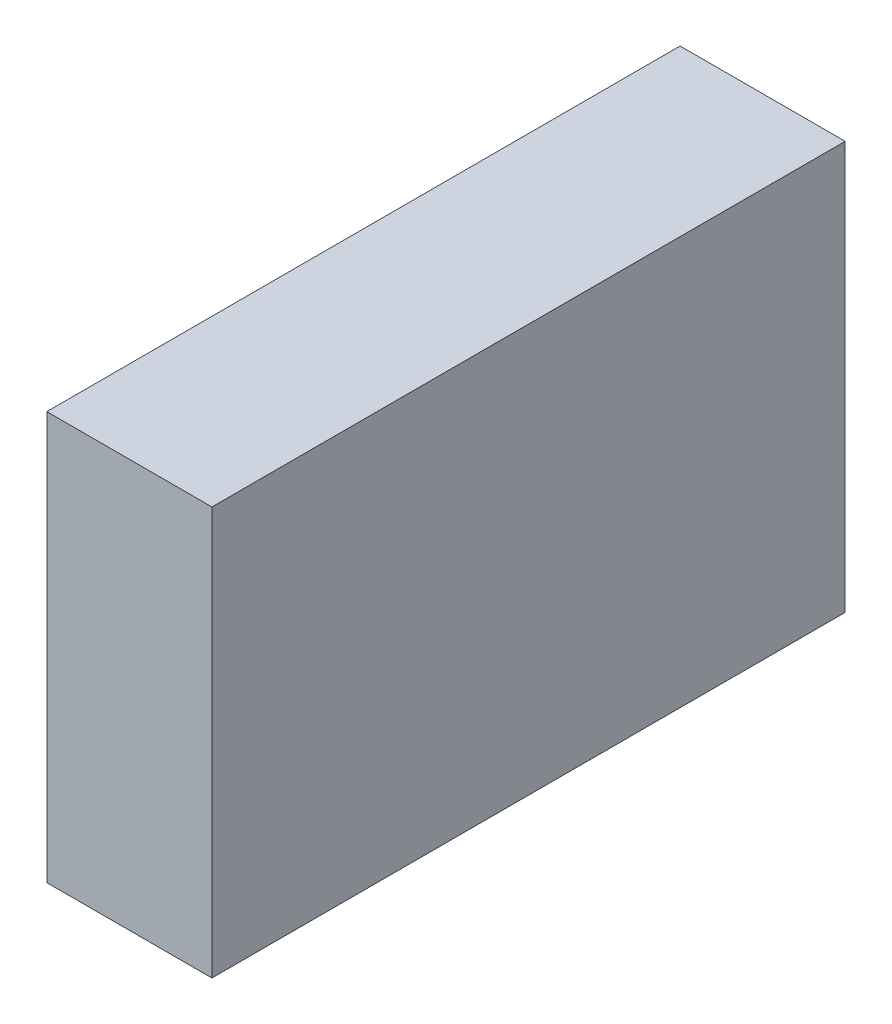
SolidWorks part; units mm, degrees
ref_plane "Front Plane" through (0, 0, 0) normal (0, 0, 1) x (1, 0, 0)
ref_plane "Top Plane" through (0, 0, 0) normal (0, 1, 0) x (1, 0, 0)
ref_plane "Right Plane" through (0, 0, 0) normal (1, 0, 0) x (0, 0, -1)
sketch "Sketch1" plane through (0, 0, 0) normal (0, 0, 1) x (1, 0, 0)
  line L1 (-42.5, 210) -> (42.5, 210)
  line L2 (-42.5, 210) -> (-42.5, 0)
  line L3 (-42.5, 0) -> (42.5, 0)
  line L4 (42.5, 210) -> (42.5, 0)
  point P4 (0, 0)
  dimension "D1" = 85
  dimension "D2" = 210
sketch "Sketch2" plane through (0, 0, 0) normal (0, 1, 0) x (1, 0, 0)
  line L0 (0, -212.5) -> (0, 212.5) construction
  point P5 (0, 0)
  dimension "D1" = 425
extrude "Boss-Extrude1" add sketch "Sketch1" against normal mid plane 326
sketch "Sketch4" plane through (-42.5, 0, 0) normal (-1, 0, 0) x (0, 0, 1)
  line L4 (163, 0) -> (163, 210)
  line L5 (163, 210) -> (-163, 210)
  line L6 (-163, 210) -> (-163, 0)
  line L7 (-163, 0) -> (163, 0)
  line L8 (163, 0) -> (163, 210)
  line L9 (163, 210) -> (-163, 210)
  line L10 (-163, 210) -> (-163, 0)
  line L11 (-163, 0) -> (163, 0)
  dimension "D1" = 0
extrude "Boss-Extrude3" add sketch "Sketch4" against normal blind 2
